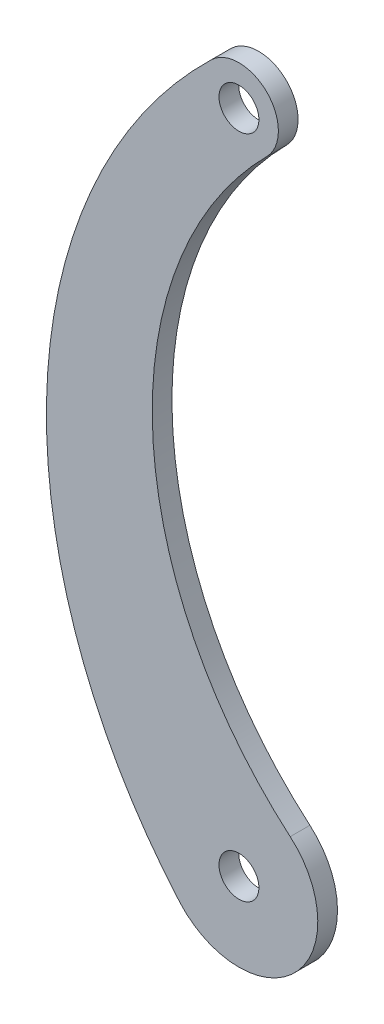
SolidWorks part; units mm, degrees
ref_plane "Plan de face" through (0, 0, 0) normal (0, 0, 1) x (1, 0, 0)
ref_plane "Plan de dessus" through (0, 0, 0) normal (0, 1, 0) x (1, 0, 0)
ref_plane "Plan de droite" through (0, 0, 0) normal (1, 0, 0) x (0, 0, -1)
sketch "Esquisse1" plane through (0, 0, 0) normal (0, 0, 1) x (1, 0, 0)
  arc A0 (10.4004, -122.8414) -> (5.6729, -5.6407) centre (62.4021, -62.0481) cw
  arc A1 (5.6729, -5.6407) -> (-5.5626, 5.7496) centre (0, 0) ccw
  arc A2 (-5.5626, 5.7496) -> (-12.0719, -145.5009) centre (70.9227, -73.3074) ccw
  arc A3 (-12.0719, -145.5009) -> (10.4004, -122.8414) centre (0, -135) ccw
  circle A4 centre (0, 0) radius 4.05
  circle A5 centre (0, -135) radius 4.05
extrude "Boss.-Extru.1" add sketch "Esquisse1" against normal blind 4
